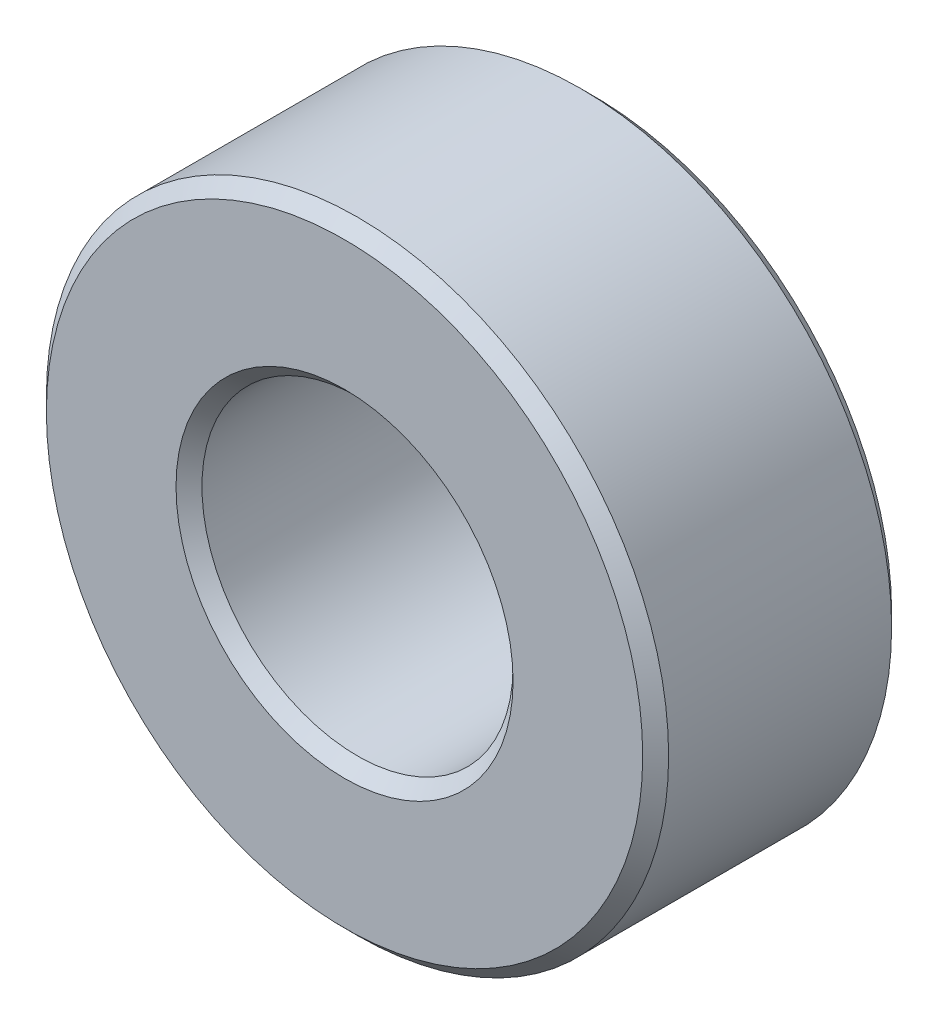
SolidWorks part; units mm, degrees
ref_plane "Plan de face" through (0, 0, 0) normal (0, 0, 1) x (1, 0, 0)
ref_plane "Plan de dessus" through (0, 0, 0) normal (0, 1, 0) x (1, 0, 0)
ref_plane "Plan de droite" through (0, 0, 0) normal (1, 0, 0) x (0, 0, -1)
sketch "Esquisse1" plane through (0, 0, 0) normal (0, 0, 1) x (1, 0, 0)
  circle A0 centre (0, 0) radius 12
  circle A1 centre (0, 0) radius 6
  dimension "D1" = 24
  dimension "D2" = 12
extrude "Extrusion1" add sketch "Esquisse1" along normal mid plane 9.6
chamfer "Chanfrein1" distance 0.5 angle 45 4 edges at (6, 0, -4.8) (6, 0, 4.8) (12, 0, -4.8) (12, 0, 4.8)
